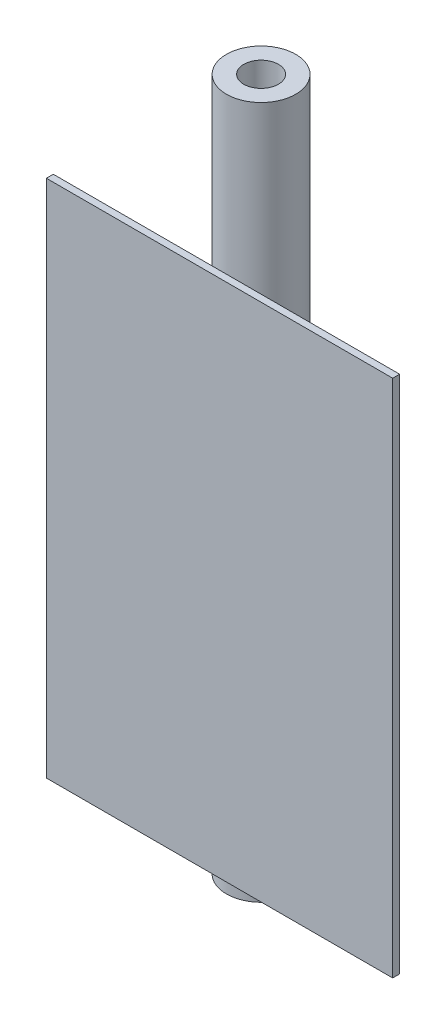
SolidWorks part; units mm, degrees
ref_plane "Ebene vorne" through (0, 0, 0) normal (0, 0, 1) x (1, 0, 0)
ref_plane "Ebene oben" through (0, 0, 0) normal (0, 1, 0) x (1, 0, 0)
ref_plane "Ebene rechts" through (0, 0, 0) normal (1, 0, 0) x (0, 0, -1)
sketch "Skizze1" plane through (0, 0, 0) normal (0, 1, 0) x (1, 0, 0)
  circle A0 centre (0, 0) radius 5
  circle A1 centre (0, 0) radius 10
  dimension "D1" = 20
  dimension "D2" = 10
extrude "Aufsatz-Linear austragen1" add sketch "Skizze1" along normal blind 200
sketch3d "3D-Skizze1" plane through (0, 0, 0) normal (0, 0, 1) x (1, 0, 0)
sketch "Skizze3" plane through (0, 0, 10) normal (0, 0, 1) x (1, 0, 0)
  line L0 (-10, 0) -> (10, 0) construction
  line L1 (-50, 5) -> (50, 5)
  line L2 (-50, 5) -> (-50, 155)
  line L3 (-50, 155) -> (50, 155)
  line L4 (50, 5) -> (50, 155)
  line L5 (-10, 200) -> (-10, 0) construction
  dimension "D1" = 100
  dimension "D2" = 150
  dimension "D3" = 5
  dimension "D4" = 40
extrude "Aufsatz-Linear austragen3" add sketch "Skizze3" along normal blind 2 separate body
